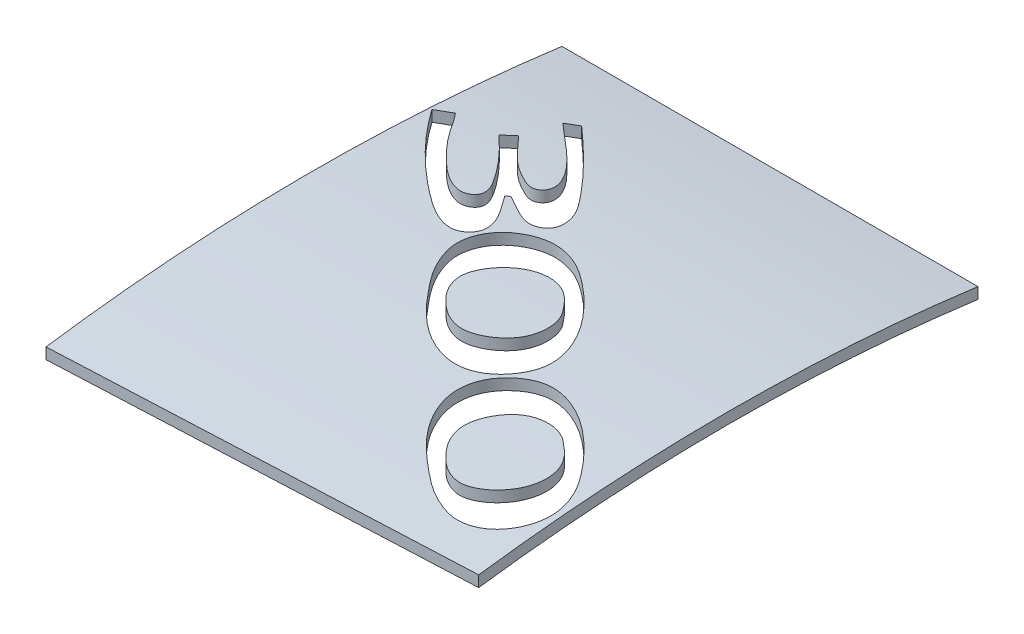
SolidWorks part; units mm, degrees
ref_plane "Front Plane" through (0, 0, 0) normal (0, 0, 1) x (1, 0, 0)
ref_plane "Top Plane" through (0, 0, 0) normal (0, 1, 0) x (1, 0, 0)
ref_plane "Right Plane" through (0, 0, 0) normal (1, 0, 0) x (0, 0, -1)
sketch "Sketch1" plane through (0, 0, 0) normal (0, 1, 0) x (1, 0, 0)
  line L0 (0, 0) -> (0, 73.8188)
  line L1 (0, 73.8188) -> (59.5312, 73.8188)
  line L2 (59.5312, 73.8188) -> (59.5313, 2.3813)
  line L3 (59.5313, 2.3813) -> (0, 0)
  dimension "D1" = 73.8188
  dimension "D2" = 71.4375
  dimension "D3" = 59.5312
extrude "Boss-Extrude1" add sketch "Sketch1" along normal blind 25.4
sketch "Sketch4" plane through (0, 25.4, 0) normal (0, 1, 0) x (1, 0, 0)
  line L0 (137.2023, 57.9419) -> (416.2738, -221.1296) construction
sketch "Sketch8" plane through (59.5313, 0, 0) normal (1, 0, 0) x (0, 0, -1)
  line L0 (2.3812, 25.4) -> (2.3812, 23.0187)
  line L1 (2.3812, 25.4) -> (2.3812, 0) construction
  line L2 (73.8188, 25.4) -> (73.8188, 23.0187)
  line L3 (73.8188, 25.4) -> (73.8188, 0) construction
  line L4 (2.3812, 25.4) -> (73.8188, 25.4)
  line L5 (2.3812, 23.0187) -> (2.3812, 21.4312)
  line L6 (73.8188, 23.0187) -> (73.8188, 21.4312)
  line L7 (2.3812, 21.4312) -> (2.3812, 0)
  line L8 (2.3812, 0) -> (73.8188, 0)
  line L9 (73.8188, 0) -> (73.8188, 21.4312)
  line L11 (2.3812, 25.4) -> (73.8188, 25.4)
  line L12 (2.3812, 25.4) -> (2.3812, 0)
  line L13 (2.3812, 0) -> (73.8188, 0)
  line L14 (73.8188, 25.4) -> (73.8188, 0)
  arc A0 (2.3812, 23.0187) -> (73.8188, 23.0187) centre (38.1, -243.6812) cw
  arc A1 (2.3812, 21.4312) -> (73.8188, 21.4312) centre (38.1, -245.2687) cw
  dimension "D1" = 2.3812
  dimension "D2" = 2.3812
  dimension "D3" = 1.5875
  dimension "D4" = 1.5875
sketch "Sketch5" plane through (0, 25.4, 0) normal (0, 1, 0) x (1, 0, 0)
  line L0 (0.382, 54.8346) -> (2.4246, 56.1402)
  line L1 (8.2133, 56.5841) -> (9.6296, 58.0004)
  line L2 (10.788, 63.1586) -> (12.3727, 64.2654)
  line L3 (17.0664, 49.4408) -> (16.6323, 49.0067)
  line L7 (29.7656, 1.1906) -> (29.7656, 17.5987) construction
  line L8 (0, 0) -> (59.5313, 2.3813) construction
  line L9 (29.7656, 17.5987) -> (48.2878, 36.1209) construction
  spline S0 degree 3 poles (12.3727, 64.2654) (15.921, 61.084) (20.2112, 56.9132) (24.2643, 51.4653) (24.4878, 48.1373) (22.1275, 47.0728) (19.6806, 47.8066) (18.2434, 48.869) (17.0664, 49.4408) knots 0 0 0 0 0.510689 0.631004 0.731222 0.81114 0.860174 1 1 1 1
  spline S1 degree 2 poles (0.382, 54.8346) (5.4617, 47.772) (12.6957, 42.634) knots 0 0 0 1 1 1
  spline S2 degree 3 poles (12.6957, 42.634) (14.0801, 41.7534) (17.0385, 39.9722) (19.3585, 42.3397) (19.7014, 45.4217) (17.5805, 47.496) (16.6323, 49.0067) knots 0 0 0 0 0.369556 0.528182 0.57402 1 1 1 1
  spline S3 degree 3 poles (2.4246, 56.1402) (3.209, 55.2793) (4.507, 53.1073) (6.8121, 50.3883) (9.2121, 48.0792) (11.3348, 46.6301) (13.4465, 46.1917) (15.2423, 47.5817) (14.5009, 49.2043) (14.1142, 49.7878) knots 0 0 0 0 0.181052 0.394102 0.554939 0.700276 0.793451 0.871366 1 1 1 1
  spline S4 degree 3 poles (14.1142, 49.7878) (12.508, 52.3315) (10.4269, 54.5629) (8.2133, 56.5841) knots 0 0 0 0 1 1 1 1
  spline S5 degree 3 poles (9.6296, 58.0004) (10.9606, 56.5894) (12.7319, 54.3758) (15.571, 52.6767) (17.5353, 51.7985) (18.747, 52.897) (18.9262, 54.178) (18.2933, 55.8597) (15.7571, 59.1631) (12.7893, 61.3171) (10.788, 63.1586) knots 0 0 0 0 0.237234 0.325278 0.41433 0.458554 0.50043 0.563505 0.669793 1 1 1 1
  spline S6 degree 3 poles (27.3926, 30.0249) (25.7228, 31.4368) (24.2064, 33.0511) (23.2253, 35.4946) (24.2054, 38.2602) (25.7824, 40.2097) (27.9215, 41.6243) (30.3627, 42.1246) (33.0484, 41.315) (34.5112, 39.6461) (35.8949, 37.9398) (36.5357, 35.6545) (35.9037, 32.8989) (34.095, 30.93) (32.1649, 29.8013) (29.7151, 29.1957) (27.3926, 30.0249) (25.7228, 31.4368) (24.2064, 33.0511) knots -0.179356 -0.127697 -0.049131 0 0.042085 0.123433 0.187573 0.260168 0.315816 0.384088 0.446927 0.523961 0.551921 0.6176 0.70017 0.759614 0.820644 0.872303 0.950869 1 1.042085 1.123433 1.187573 only from (25.6812, 31.5229) to (25.6812, 31.5229)
  spline S7 degree 3 poles (24.7407, 29.6179) (22.8412, 31.9145) (21.0258, 34.2161) (19.8106, 36.6447) (18.9586, 39.6933) (19.8525, 43.3839) (22.7959, 45.7925) (26.1828, 46.7478) (29.5676, 46.0967) (33.3414, 43.5798) (36.9342, 40.2347) (40.0633, 35.9291) (41.3832, 31.2189) (39.538, 27.663) (37.2016, 25.4834) (33.9094, 24.4779) (30.3015, 25.3378) (27.149, 27.2731) (24.7407, 29.6179) (22.8412, 31.9145) (21.0258, 34.2161) knots -0.15284 -0.095013 -0.041367 0 0.041312 0.092344 0.123073 0.184735 0.252934 0.286141 0.343576 0.40302 0.492063 0.566126 0.647266 0.697078 0.741053 0.791055 0.84716 0.904987 0.958633 1 1.041312 1.092344 1.123073 only from (22.8478, 31.923) to (22.8478, 31.923)
  spline S8 degree 3 poles (41.7848, 12.5738) (44.0814, 10.6743) (46.383, 8.8589) (48.8116, 7.6437) (51.8602, 6.7917) (55.5508, 7.6856) (57.9594, 10.629) (58.9147, 14.0159) (58.2636, 17.4007) (55.7467, 21.1745) (52.4016, 24.7673) (48.096, 27.8964) (43.3858, 29.2163) (39.8299, 27.3711) (37.6503, 25.0347) (36.6448, 21.7425) (37.5047, 18.1346) (39.44, 14.9821) (41.7848, 12.5738) (44.0814, 10.6743) (46.383, 8.8589) knots -0.15284 -0.095013 -0.041367 0 0.041312 0.092344 0.123073 0.184735 0.252934 0.286141 0.343576 0.40302 0.492063 0.566126 0.647266 0.697078 0.741053 0.791055 0.84716 0.904987 0.958633 1 1.041312 1.092344 1.123073 only from (44.0899, 10.6809) to (44.0899, 10.6809)
  spline S9 degree 3 poles (42.1917, 15.2257) (43.6037, 13.5559) (45.218, 12.0395) (47.6615, 11.0584) (50.4271, 12.0385) (52.3766, 13.6155) (53.7912, 15.7546) (54.2915, 18.1958) (53.4819, 20.8815) (51.813, 22.3443) (50.1067, 23.728) (47.8214, 24.3688) (45.0658, 23.7368) (43.0969, 21.9281) (41.9682, 19.998) (41.3626, 17.5482) (42.1917, 15.2257) (43.6037, 13.5559) (45.218, 12.0395) knots -0.179356 -0.127697 -0.049131 0 0.042085 0.123433 0.187573 0.260168 0.315816 0.384088 0.446927 0.523961 0.551921 0.6176 0.70017 0.759614 0.820644 0.872303 0.950869 1 1.042085 1.123433 1.187573 only from (43.6898, 13.5143) to (43.6898, 13.5143)
  dimension "D1" = 135
extrude "Cut-Extrude1" cut sketch "Sketch5" against normal through all
extrude "Cut-Extrude6" cut sketch "Sketch8" against normal through all contours A0 L11 M8 | A0 M7 M6 | A1 M8 M5 M6
sketch "Sketch9" plane through (59.5313, 0, 0) normal (1, 0, 0) x (0, 0, -1)
  line L1 (-2.3813, 33.1603) -> (72.539, 33.1603)
  line L2 (73.8187, 21.4313) -> (73.8188, 23.0188)
  line L3 (2.3812, 23.0187) -> (2.3813, 21.4313)
  line L4 (73.8187, 21.4313) -> (73.8188, 23.0188)
  line L5 (2.3812, 23.0187) -> (2.3813, 21.4313)
  line L6 (-2.3813, 33.1603) -> (-2.3813, -3.8293)
  line L7 (-2.3813, -3.8293) -> (72.539, -3.8293)
  line L8 (72.539, 33.1603) -> (72.539, -3.8293)
  arc A2 (73.8187, 21.4313) -> (2.3813, 21.4313) centre (38.1, -245.2687) ccw
  arc A3 (73.8188, 23.0188) -> (2.3812, 23.0187) centre (38.1, -243.6812) ccw
  arc A4 (73.8187, 21.4313) -> (2.3813, 21.4313) centre (38.1, -245.2687) ccw
  arc A5 (73.8188, 23.0188) -> (2.3812, 23.0187) centre (38.1, -243.6812) ccw
  dimension "D1" = 0
extrude "Cut-Extrude7" cut sketch "Sketch9" against normal through all contours L8 L1 L6 L7 M7 M6 M5
sketch "Sketch10" plane through (0, 0, 0) normal (-1, 0, 0) x (0, 0, 1)
  line L0 (0, 25.4) -> (0, 23.0187) construction
  line L1 (0, 23.0187) -> (0, 22.689) construction
  line L2 (0, 22.689) -> (0, 25.4)
  line L3 (0, 22.689) -> (0, 21.1015)
  line L4 (-2.3812, 21.4313) -> (-2.3813, 0)
  line L5 (0, 0) -> (-2.3813, 0)
  line L6 (-2.3812, 21.4313) -> (-2.3813, 0)
  line L7 (-2.3813, 0) -> (0, 0)
  line L8 (0, 0) -> (0, 25.4)
  line L9 (0, 25.4) -> (-2.3813, 25.4)
  line L10 (-2.3813, 25.4) -> (-2.3812, 23.0188)
  line L11 (-73.8188, 23.0187) -> (-73.8188, 21.4313)
  line L12 (-2.3812, 21.4313) -> (-2.3813, 0)
  line L13 (-2.3813, 0) -> (0, 0)
  line L14 (0, 0) -> (0, 21.1015)
  line L15 (0, 25.4) -> (-2.3813, 25.4)
  line L16 (-2.3813, 25.4) -> (-2.3812, 23.0188)
  line L17 (-73.8188, 23.0187) -> (-73.8188, 21.4313)
  line L18 (0, 0) -> (0, 21.1015)
  arc A0 (-73.8188, 23.0187) -> (0, 22.689) centre (-38.1, -243.6812) cw
  arc A1 (-73.8188, 21.4313) -> (0, 21.1015) centre (-38.1, -245.2687) cw
  arc A2 (-2.3812, 21.4313) -> (-73.8188, 21.4313) centre (-38.1, -245.2687) ccw
  arc A3 (-2.3812, 23.0188) -> (-73.8188, 23.0187) centre (-38.1, -243.6812) ccw
  arc A4 (-2.3812, 21.4313) -> (-73.8188, 21.4313) centre (-38.1, -245.2687) ccw
  arc A5 (-2.3812, 23.0188) -> (-73.8188, 23.0187) centre (-38.1, -243.6812) ccw
  dimension "D1" = 0
  dimension "D2" = 2.3813
extrude "Cut-Extrude8" cut sketch "Sketch10" against normal through all contours A1 M11 M12 M13 | A0 M15 M13 M14
